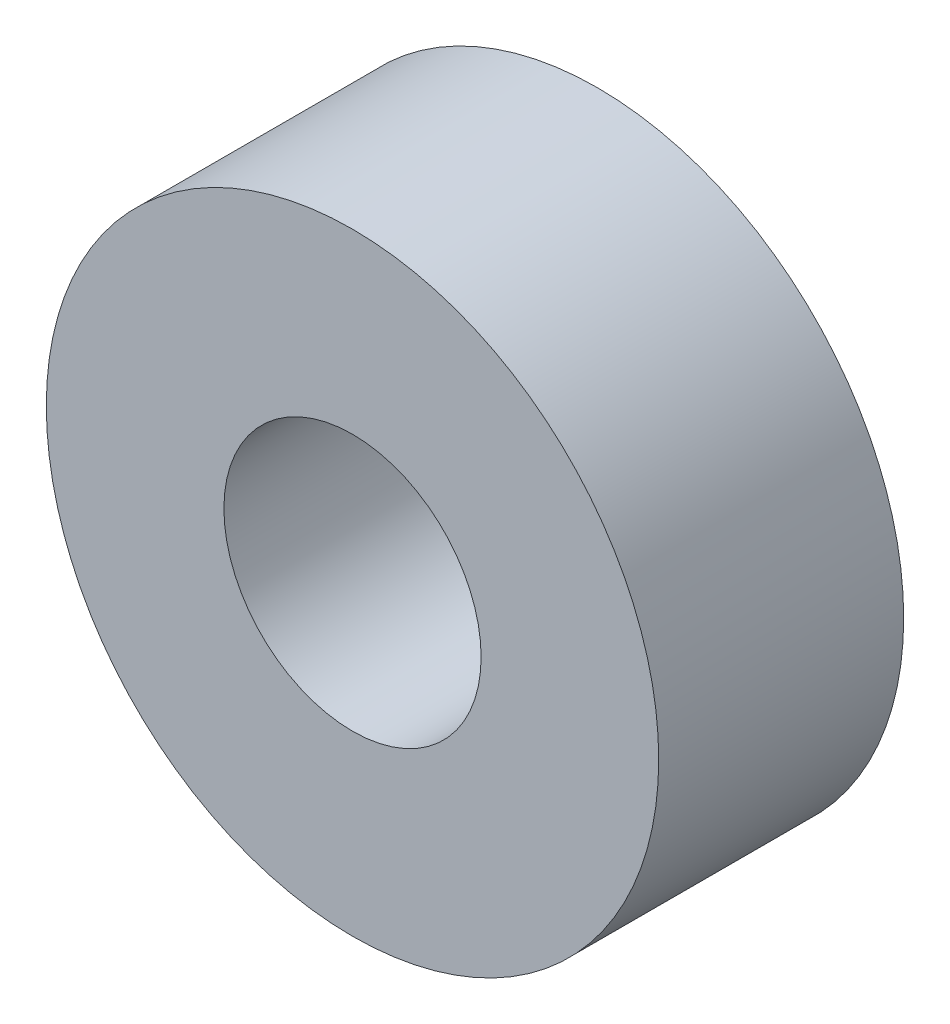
SolidWorks part; units mm, degrees
ref_plane "Plan de face" through (0, 0, 0) normal (0, 0, 1) x (1, 0, 0)
ref_plane "Plan de dessus" through (0, 0, 0) normal (0, 1, 0) x (1, 0, 0)
ref_plane "Plan de droite" through (0, 0, 0) normal (1, 0, 0) x (0, 0, -1)
sketch "Esquisse1" plane through (0, 0, 0) normal (0, 0, 1) x (1, 0, 0)
  circle A0 centre (0, 0) radius 25
  dimension "D1" = 50
extrude "Boss.-Extru.1" add sketch "Esquisse1" along normal blind 20
hole_wizard "Trou taraudé M241" positions "Esquisse2" profile "Esquisse3" tap size "M24" standard "ISO"
sketch "Esquisse2" plane through (0, 0, 20) normal (0, 0, 1) x (1, 0, 0)
  point P0 (0, 0)
sketch "Esquisse3" plane through (0, 0, 20) normal (1, 0, 0) x (0, -1, 0)
  line L0 (0, 0) -> (0, 20)
  line L1 (0, 20) -> (10.5, 20)
  line L2 (10.5, 20) -> (10.5, 0)
  line L5 (10.5, 0) -> (0, 0)
  line L11 (0, -6.35) -> (0, 107.95) construction
  dimension "Diamètre du trou pour taraudage jusqu'au prochain" = 21
  dimension "Profondeur du trou pour taraudage jusqu'au prochain" = 20
